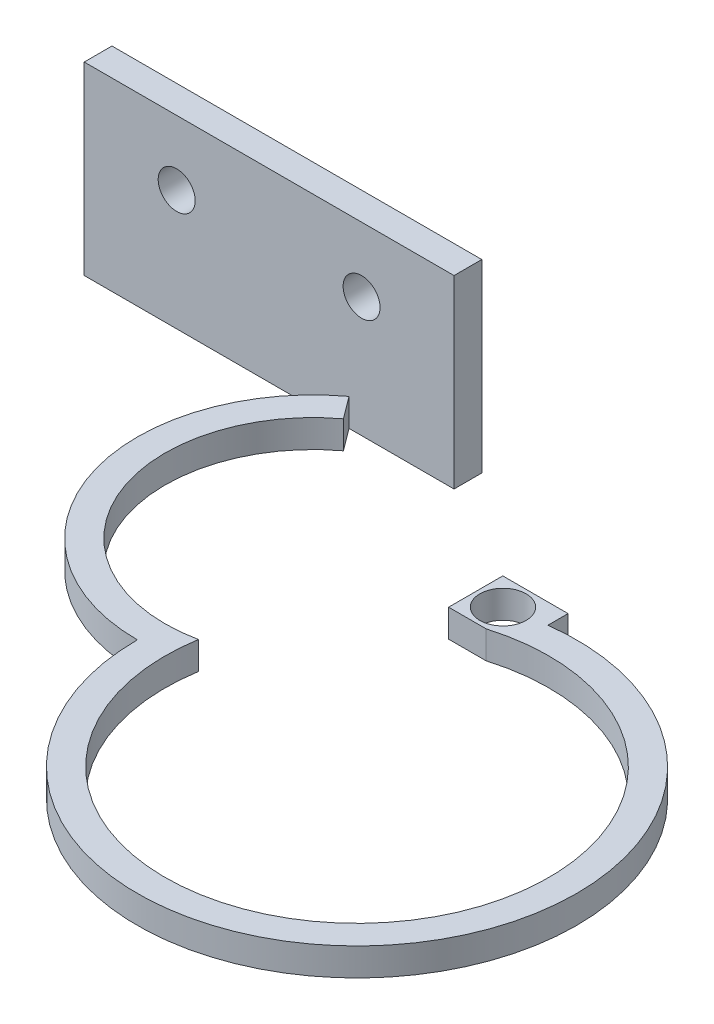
SolidWorks part; units mm, degrees
ref_plane "Ebene vorne" through (0, 0, 0) normal (0, 0, 1) x (1, 0, 0)
ref_plane "Ebene oben" through (0, 0, 0) normal (0, 1, 0) x (1, 0, 0)
ref_plane "Ebene rechts" through (0, 0, 0) normal (1, 0, 0) x (0, 0, -1)
sketch "Skizze1" plane through (0, 0, 0) normal (0, 0, 1) x (1, 0, 0)
  line L1 (0, 0) -> (40, 0)
  line L2 (0, 0) -> (0, 20)
  line L3 (0, 20) -> (40, 20)
  line L4 (40, 0) -> (40, 20)
  circle A0 centre (10, 13) radius 2
  circle A1 centre (30, 13) radius 2
  dimension "D6" = 4
  dimension "D7" = 4
  dimension "D1" = 40
  dimension "D2" = 20
  dimension "D3" = 10
  dimension "D4" = 20
  dimension "D5" = 13
  dimension "D8" = 13
extrude "Aufsatz-Linear austragen1" add sketch "Skizze1" along normal blind 3
sketch "Skizze2" plane through (0, 0, 0) normal (0, -1, 0) x (1, 0, 0)
  line L0 (0, 3) -> (40, 3) construction
  line L1 (60.8324, 13.6766) -> (60.8324, 11.5)
  line L2 (60.8324, 11.5) -> (53.7716, 11.5)
  line L3 (57.8324, 17.3595) -> (53.7716, 17.3595)
  line L4 (53.7716, 17.3595) -> (53.7716, 11.5)
  line L5 (28.6441, 3) -> (30.4362, 5.4059)
  line L7 (57.8324, 14.5) -> (53.7716, 14.5) construction
  line L8 (57.8324, 17.3595) -> (57.8324, 14.5) construction
  circle A0 centre (56.7063, 14.4133) radius 2.5
  arc A1 (40, 37.2538) -> (60.8324, 13.6766) centre (63.758, 37.2538) cw
  arc A2 (40, 37.2538) -> (28.6441, 3) centre (40, 18.2445) ccw
  arc A3 (43.2701, 33.9162) -> (57.8324, 17.3595) centre (63.758, 37.2538) cw
  arc A4 (43.2701, 33.9162) -> (30.4362, 5.4059) centre (40, 18.2445) ccw
  dimension "D9" = 5
  dimension "D1" = 3
extrude "Aufsatz-Linear austragen2" add sketch "Skizze2" against normal blind 3
